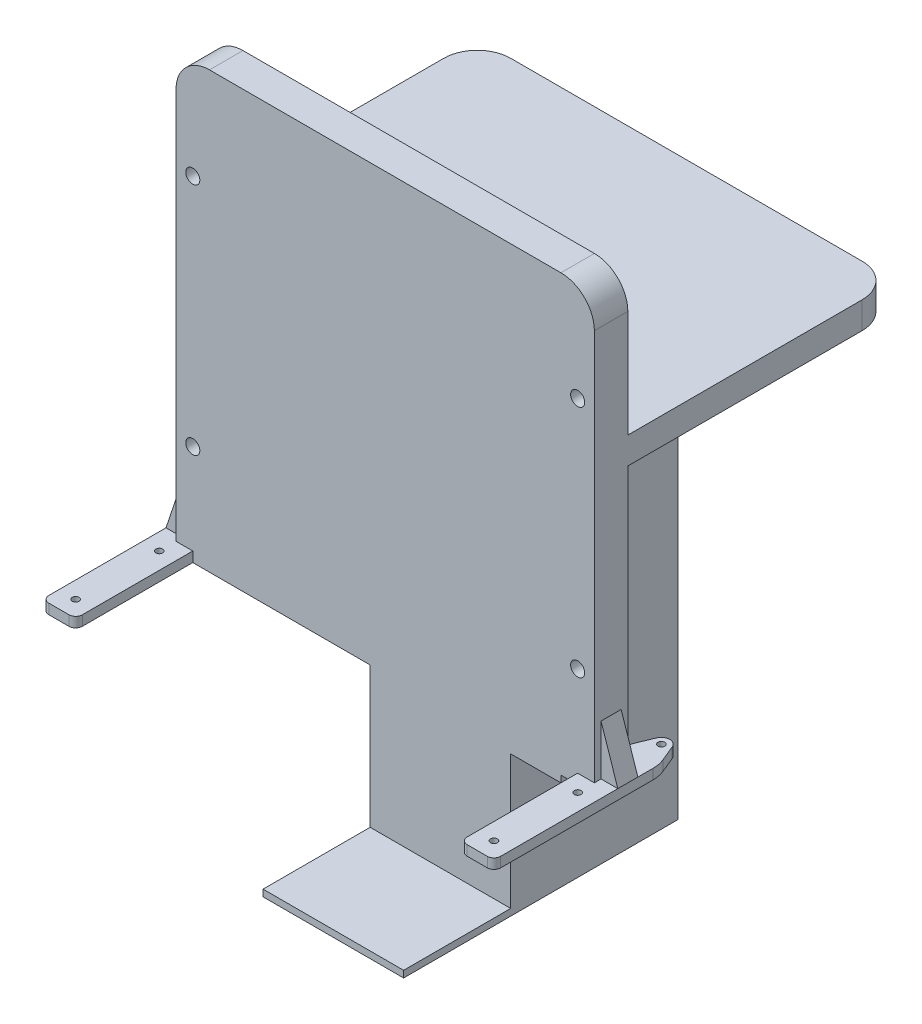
SolidWorks part; units mm, degrees
ref_plane "前视基准面" through (0, 0, 0) normal (0, 0, 1) x (1, 0, 0)
ref_plane "上视基准面" through (0, 0, 0) normal (0, 1, 0) x (1, 0, 0)
ref_plane "右视基准面" through (0, 0, 0) normal (1, 0, 0) x (0, 0, -1)
sketch "草图1" plane through (0, 0, 0) normal (0, 1, 0) x (1, 0, 0)
  line L0 (0, 0) -> (0, 70.4322) construction
  line L1 (-64.8097, 50.9567) -> (-66.7388, 46.2995)
  line L2 (-67.5, 42.4726) -> (-67.5, 22)
  line L3 (-65.5, 20) -> (-59.5, 20)
  line L4 (-62.5, 50) -> (-62.5, 20) construction
  line L5 (-57.5, 42.4726) -> (-57.5, 22)
  line L6 (-60.1903, 50.9567) -> (-58.2612, 46.2995)
  line L7 (62.5, 50) -> (62.5, 20) construction
  line L8 (60.1903, 50.9567) -> (58.2612, 46.2995)
  line L9 (57.5, 42.4726) -> (57.5, 22)
  line L10 (65.5, 20) -> (59.5, 20)
  line L11 (67.5, 42.4726) -> (67.5, 22)
  line L12 (64.8097, 50.9567) -> (66.7388, 46.2995)
  arc A0 (-60.1903, 50.9567) -> (-64.8097, 50.9567) centre (-62.5, 50) ccw
  arc A1 (-57.5, 42.4726) -> (-58.2612, 46.2995) centre (-67.5, 42.4726) ccw
  arc A2 (-66.7388, 46.2995) -> (-67.5, 42.4726) centre (-57.5, 42.4726) ccw
  arc A3 (-67.5, 22) -> (-65.5, 20) centre (-65.5, 22) ccw
  arc A4 (-57.5, 22) -> (-59.5, 20) centre (-59.5, 22) cw
  arc A5 (57.5, 22) -> (59.5, 20) centre (59.5, 22) ccw
  arc A6 (67.5, 22) -> (65.5, 20) centre (65.5, 22) cw
  arc A7 (66.7388, 46.2995) -> (67.5, 42.4726) centre (57.5, 42.4726) cw
  arc A8 (57.5, 42.4726) -> (58.2612, 46.2995) centre (67.5, 42.4726) cw
  arc A9 (60.1903, 50.9567) -> (64.8097, 50.9567) centre (62.5, 50) cw
  point P14 (-57.5, 44.4617)
  point P17 (-67.5, 44.4617)
  point P20 (-67.5, 20)
  point P23 (-57.5, 20)
  point P38 (57.5, 20)
  point P39 (67.5, 20)
  point P40 (67.5, 44.4617)
  point P41 (57.5, 44.4617)
  dimension "D2" = 5
  dimension "D3" = 50
  dimension "D7" = 10
  dimension "D8" = 2
  dimension "D6" = 30
extrude "凸台-拉伸1" add sketch "草图1" along normal blind 3
hole_wizard "M2.5 螺纹孔2" positions "3D草图1" profile "草图2" tap size "M2.5" standard "GB"
sketch3d "3D草图1"
  line L0 (-62.5, 3, -50) -> (-62.5, 0, -50) construction
  line L1 (62.5, 3, -50) -> (62.5, 0, -50) construction
  point P0 (-62.5, 3, -50)
  point P4 (62.5, 3, -50)
sketch "草图2" plane through (-62.5, 3, -50) normal (1, 0, 0) x (0, 0, 1)
  line L0 (0, 0) -> (0, 7.8659)
  line L1 (0, 7.8659) -> (1.025, 7.25)
  line L2 (1.025, 7.25) -> (1.025, 0)
  line L5 (1.025, 0) -> (0, 0)
  line L10 (0, 7.8659) -> (-1.025, 7.25) construction
  line L11 (0, -6.35) -> (0, 107.95) construction
  dimension "螺纹孔钻头直径" = 2.05
  dimension "螺纹孔钻头深度" = 7.25
  dimension "导头角度" = 118
pattern_linear "阵列(线性)1" count 2 spacing 25 along (0, 0, 1) of "M2.5 螺纹孔2"
ref_plane "基准面1" through (0, 0, -35) normal (0, 0, 1) x (1, 0, 0)
sketch "草图4" plane through (0, 0, -35) normal (0, 0, 1) x (1, 0, 0)
  line L0 (-65.5, 0) -> (-59.5, 0) construction
  line L1 (62.5, 130) -> (-62.5, 130)
  line L2 (62.5, 130) -> (62.5, 0)
  line L3 (62.5, 0) -> (-62.5, 0)
  line L4 (-62.5, 130) -> (-62.5, 0)
  line L5 (62.5, 130) -> (-62.5, 0) construction
  line L6 (62.5, 0) -> (-62.5, 130) construction
  point P0 (0, 65)
  dimension "D1" = 130
extrude "凸台-拉伸2" add sketch "草图4" along normal mid plane 10
sketch "草图5" plane through (0, 0, -35) normal (0, 0, 1) x (1, 0, 0)
  line L0 (-67.5, 3) -> (-62.5, 18)
  line L1 (-62.5, 130) -> (-62.5, 3) construction
  line L2 (-62.5, 18) -> (-62.5, 3)
  line L3 (-65.5, 3) -> (-59.5, 3) construction
  line L4 (-62.5, 3) -> (-67.5, 3)
  line L5 (62.5, 3) -> (62.5, 18)
  line L6 (62.5, 3) -> (62.5, 130) construction
  line L7 (62.5, 18) -> (67.5, 3)
  line L8 (67.5, 3) -> (62.5, 3)
  dimension "D1" = 15
  dimension "D2" = 15
extrude "凸台-拉伸3" add sketch "草图5" along normal mid plane 6
sketch "草图6" plane through (0, 0, -40) normal (0, 0, -1) x (-1, 0, 0)
  line L0 (-62.5, 3) -> (-62.5, 130) construction
  line L1 (62.5, 88) -> (-62.5, 88)
  line L2 (62.5, 88) -> (62.5, 80)
  line L3 (62.5, 80) -> (-62.5, 80)
  line L4 (-62.5, 88) -> (-62.5, 80)
  line L5 (62.5, 88) -> (-62.5, 80) construction
  line L6 (62.5, 80) -> (-62.5, 88) construction
  line L7 (57.5, 0) -> (-57.5, 0) construction
  point P0 (0, 84)
  dimension "D1" = 8
  dimension "D2" = 80
  dimension "D3" = 125
extrude "凸台-拉伸4" add sketch "草图6" along normal blind 80
sketch "草图7" plane through (0, 0, 0) normal (1, 0, 0) x (0, 0, -1)
  line L0 (80, 80) -> (40, 41.5)
  line L1 (120, 80) -> (40, 80) construction
  line L2 (40, 3) -> (40, 80) construction
sketch "草图23" plane through (0, 3, 0) normal (0, 1, 0) x (1, 0, 0)
  line L0 (-67.5, 22) -> (-67.5, -3)
  line L1 (-65.5, -5) -> (-59.5, -5)
  line L2 (-57.5, -3) -> (-57.5, 22)
  line L3 (-65.5, 20) -> (-59.5, 20) construction
  line L4 (-65.5, 20) -> (-59.5, 20)
  arc A0 (-67.5, 22) -> (-65.5, 20) centre (-65.5, 22) ccw construction
  arc A1 (-67.5, 22) -> (-65.5, 20) centre (-65.5, 22) ccw
  arc A2 (-59.5, 20) -> (-57.5, 22) centre (-59.5, 22) ccw construction
  arc A3 (-59.5, 20) -> (-57.5, 22) centre (-59.5, 22) ccw
  arc A4 (-59.5, -5) -> (-57.5, -3) centre (-59.5, -3) ccw
  arc A5 (-67.5, -3) -> (-65.5, -5) centre (-65.5, -3) ccw
  dimension "D2" = 2
  dimension "D1" = 25
extrude "凸台-拉伸17" add sketch "草图23" against normal up to surface (3 mm away)
fillet "圆角1" radius 10 4 edges at (62.5, 84, -120) (-62.5, 84, -120) (-62.5, 130, -35) (62.5, 130, -35)
sketch "草图10" plane through (0, 0, -35) normal (0, 0, 1) x (1, 0, 0)
  line L5 (52.5, 0) -> (52.5, -2)
  line L6 (-57.5, 0) -> (57.5, 0) construction
  line L7 (52.5, -2) -> (37.5, -2)
  line L8 (37.5, -2) -> (37.5, 0)
  line L9 (37.5, 0) -> (52.5, 0)
  line L10 (57.5, 3) -> (57.5, 0) construction
  dimension "D1" = 5
  dimension "D2" = 15
  dimension "D3" = 2
extrude "凸台-拉伸7" add sketch "草图10" along normal mid plane 10
mirror "镜向2" about plane through (0, 0, 0) normal (1, 0, 0) of "凸台-拉伸7"
sketch "草图15" plane through (0, 0, 0) normal (0, -1, 0) x (1, 0, 0)
  line L1 (-37.5, -40) -> (37.5, -40)
  line L2 (-37.5, -40) -> (-37.5, -30)
  line L3 (-37.5, -30) -> (37.5, -30)
  line L4 (37.5, -40) -> (37.5, -30)
extrude "凸台-拉伸12" add sketch "草图15" along normal blind 44
sketch "草图17" plane through (0, 0, -30) normal (0, 0, 1) x (1, 0, 0)
  line L0 (37.5, -44) -> (37.5, -2) construction
  line L1 (-37.5, -44) -> (37.5, -44)
  line L2 (-37.5, -44) -> (-37.5, -42)
  line L3 (-37.5, -42) -> (37.5, -42)
  line L4 (37.5, -44) -> (37.5, -42)
  dimension "D1" = 2
extrude "凸台-拉伸14" add sketch "草图17" along normal blind 32
sketch "草图19" plane through (0, 0, -40) normal (0, 0, -1) x (-1, 0, 0)
  line L0 (37.5, -44) -> (37.5, -2) construction
  line L1 (-37.5, -44) -> (37.5, -44)
  line L2 (-37.5, -44) -> (-37.5, -42)
  line L3 (-37.5, -42) -> (37.5, -42)
  line L4 (37.5, -44) -> (37.5, -42)
  dimension "D1" = 2
extrude "凸台-拉伸15" add sketch "草图19" along normal blind 40
sketch "草图24" plane through (0, 3, 0) normal (0, 1, 0) x (1, 0, 0)
  line L0 (-62.5, 25) -> (-62.5, 0) construction
  dimension "D1" = 25
hole_wizard "M2.5 螺纹孔1" positions "3D草图3" profile "草图26" tap size "M2.5" standard "GB"
sketch3d "3D草图3"
  point P0 (-62.5, 3, 0)
sketch "草图26" plane through (-62.5, 3, 0) normal (1, 0, 0) x (0, 0, 1)
  line L0 (0, 0) -> (0, 7.8659)
  line L1 (0, 7.8659) -> (1.025, 7.25)
  line L2 (1.025, 7.25) -> (1.025, 0)
  line L5 (1.025, 0) -> (0, 0)
  line L10 (0, 7.8659) -> (-1.025, 7.25) construction
  line L11 (0, -6.35) -> (0, 107.95) construction
  dimension "螺纹孔钻头直径" = 2.05
  dimension "螺纹孔钻头深度" = 7.25
  dimension "导头角度" = 118
mirror "镜向3" about plane through (0, 0, 0) normal (1, 0, 0) of "M2.5 螺纹孔1", "凸台-拉伸17"
sketch "草图27" plane through (0, 0, -30) normal (0, 0, 1) x (1, 0, 0)
  line L0 (-62.5, 120) -> (-62.5, 3) construction
  line L1 (57.5, 105) -> (-57.5, 105)
  line L2 (62.5, 100) -> (62.5, 30)
  line L3 (57.5, 25) -> (-57.5, 25)
  line L4 (-62.5, 100) -> (-62.5, 30)
  line L5 (62.5, 105) -> (-62.5, 25) construction
  line L6 (62.5, 25) -> (-62.5, 105) construction
  line L7 (52.5, 130) -> (-52.5, 130) construction
  arc A0 (-57.5, 105) -> (-62.5, 100) centre (-57.5, 100) ccw
  arc A1 (62.5, 30) -> (57.5, 25) centre (57.5, 30) cw
  arc A2 (57.5, 105) -> (62.5, 100) centre (57.5, 100) cw
  arc A3 (-57.5, 25) -> (-62.5, 30) centre (-57.5, 30) cw
  point P0 (0, 65)
  dimension "D2" = 5
  dimension "D1" = 80
  dimension "D3" = 65
  dimension "D4" = 125
hole_wizard "M5 螺纹孔1" positions "3D草图4" profile "草图28" tap size "M5" standard "IS"
sketch3d "3D草图4"
  point P0 (-57.5, 100, -30)
  point P3 (57.5, 100, -30)
  point P6 (-57.5, 30, -30)
  point P9 (57.5, 30, -30)
sketch "草图28" plane through (-57.5, 100, -30) normal (1, 0, 0) x (0, -1, 0)
  line L0 (0, 0) -> (0, 13.6618)
  line L1 (0, 13.6618) -> (2.1, 12.4)
  line L2 (2.1, 12.4) -> (2.1, 0)
  line L5 (2.1, 0) -> (0, 0)
  line L10 (0, 13.6618) -> (-2.1, 12.4) construction
  line L11 (0, -6.35) -> (0, 107.95) construction
  dimension "螺纹孔钻头直径" = 4.2
  dimension "螺纹孔钻头深度" = 12.4
  dimension "导头角度" = 118
sketch "草图29" plane through (-37.5, 0, 0) normal (-1, 0, 0) x (0, 0, 1)
  line L0 (-80, -42) -> (-80, 80)
  line L1 (-110, 80) -> (-40, 80) construction
rib "筋1" sketch "草图29" sketch "草图29" thickness 10 extrusion direction parallel to sketch draft on no parameters "D1"=10
mirror "镜向4" about plane through (0, 0, 0) normal (1, 0, 0) of "筋1"
sketch "草图30" plane through (0, 0, -30) normal (0, 0, 1) x (1, 0, 0)
  line L1 (-4.5, -2) -> (-4.5, -44)
  line L2 (-37.5, -44) -> (37.5, -44) construction
  line L3 (-4.5, -44) -> (-37.5, -44)
  line L4 (-37.5, -44) -> (-37.5, -2)
  line L5 (-52.5, 0) -> (-4.5, 0)
  line L6 (-4.5, 0) -> (-4.5, -2)
  line L7 (-52.5, 0) -> (-52.5, -2)
  line L8 (-52.5, -2) -> (-37.5, -2)
  dimension "D1" = 33
extrude "切除-拉伸1" cut sketch "草图30" against normal blind 45 and the other way through all
